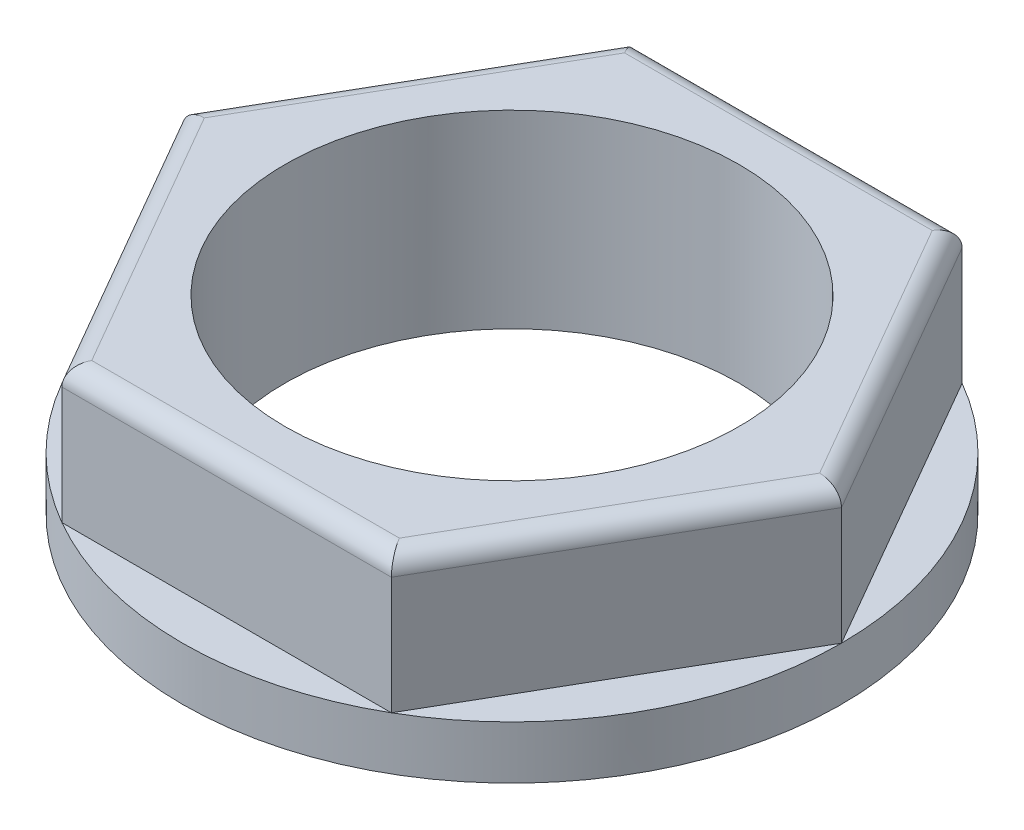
SolidWorks part; units mm, degrees
ref_plane "Спереди" through (0, 0, 0) normal (0, 0, 1) x (1, 0, 0)
ref_plane "Сверху" through (0, 0, 0) normal (0, 1, 0) x (1, 0, 0)
ref_plane "Справа" through (0, 0, 0) normal (1, 0, 0) x (0, 0, -1)
sketch "Эскиз1" plane through (0, 0, 0) normal (0, 1, 0) x (1, 0, 0)
  circle A0 centre (0, 0) radius 8.7
extrude "Бобышка-Вытянуть1" add sketch "Эскиз1" along normal blind 1.4
sketch "Sketch2" plane through (0, 1.4, 0) normal (0, 1, 0) x (1, 0, 0)
  line L6 (4.35, 7.5344) -> (-4.35, 7.5344)
  line L7 (-4.35, 7.5344) -> (-8.7, 0)
  line L8 (-8.7, 0) -> (-4.35, -7.5344)
  line L9 (-4.35, -7.5344) -> (4.35, -7.5344)
  line L10 (4.35, -7.5344) -> (8.7, 0)
  line L11 (8.7, 0) -> (4.35, 7.5344)
  circle A0 centre (0, 0) radius 8.7 construction
extrude "Boss-Extrude1" add sketch "Sketch2" along normal blind 3.6
fillet "Fillet1" radius 0.5 6 edges at (6.525, 5, 3.7672) (0, 5, 7.5344) (-6.525, 5, 3.7672) (-6.525, 5, -3.7672) (0, 5, -7.5344) (6.525, 5, -3.7672)
sketch "Sketch3" plane through (0, 0, 0) normal (0, -1, 0) x (1, 0, 0)
  circle A0 centre (0, 0) radius 5.9944
extrude "Cut-Extrude1" cut sketch "Sketch3" against normal up to surface (5 mm away)
